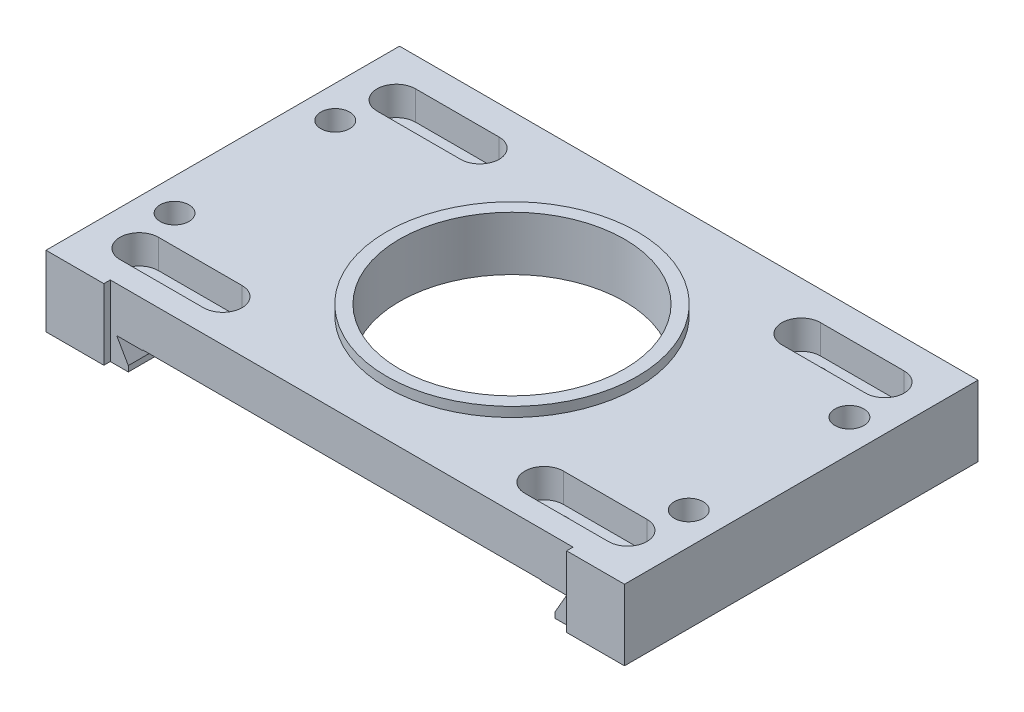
SolidWorks part; units mm, degrees
ref_plane "Front Plane" through (0, 0, 0) normal (0, 0, 1) x (1, 0, 0)
ref_plane "Top Plane" through (0, 0, 0) normal (0, 1, 0) x (1, 0, 0)
ref_plane "Right Plane" through (0, 0, 0) normal (1, 0, 0) x (0, 0, -1)
sketch "Sketch1" plane through (0, 0, 0) normal (1, 0, 0) x (0, 0, -1)
  line L1 (-27.5, -5.5) -> (27.5, -5.5)
  line L2 (-27.5, -5.5) -> (-27.5, 5.5)
  line L3 (-27.5, 5.5) -> (27.5, 5.5)
  line L4 (27.5, -5.5) -> (27.5, 5.5)
  line L5 (-27.5, -5.5) -> (27.5, 5.5) construction
  line L6 (-27.5, 5.5) -> (27.5, -5.5) construction
  point P0 (0, 0)
  dimension "D1" = 11
  dimension "D2" = 55
extrude "Boss-Extrude1" add sketch "Sketch1" along normal mid plane 90
sketch "Sketch2" plane through (0, 0, 27.5) normal (0, 0, 1) x (1, 0, 0)
  line L0 (-32.6906, -5.5) -> (-35, -1.5)
  line L1 (45, -5.5) -> (-45, -5.5) construction
  line L2 (-35, -1.5) -> (35, -1.5)
  line L3 (35, -1.5) -> (32.6906, -5.5)
  line L4 (32.6906, -5.5) -> (-32.6906, -5.5)
  dimension "D1" = 60
  dimension "D2" = 60
  dimension "D3" = 4
  dimension "D4" = 70
  dimension "D5" = 35
extrude "Cut-Extrude1" cut sketch "Sketch2" against normal through all
sketch "Sketch15" plane through (0, -1.5, 0) normal (0, -1, 0) x (1, 0, 0)
  line L0 (35, 27.5) -> (-35, 27.5) construction
  line L1 (-31, -27.5) -> (31, -27.5)
  line L2 (-31, -27.5) -> (-31, 27.5)
  line L3 (-31, 27.5) -> (31, 27.5)
  line L4 (31, -27.5) -> (31, 27.5)
  line L5 (-31, -27.5) -> (31, 27.5) construction
  line L6 (-31, 27.5) -> (31, -27.5) construction
  point P0 (0, 0)
  dimension "D1" = 62
extrude "Cut-Extrude3" cut sketch "Sketch15" against normal blind 0.1
sketch "Sketch16" plane through (0, 0, 27.5) normal (0, 0, 1) x (1, 0, 0)
  line L0 (-32.6906, -5.5) -> (-45, -5.5) construction
  line L1 (-36, -5.5) -> (36, -5.5)
  line L2 (-36, -5.5) -> (-36, 5.5)
  line L3 (-36, 5.5) -> (36, 5.5)
  line L4 (36, -5.5) -> (36, 5.5)
  line L5 (45, 5.5) -> (-45, 5.5) construction
  line L6 (45, 5.5) -> (45, -5.5) construction
  dimension "D1" = 72
  dimension "D2" = 9
extrude "Cut-Extrude4" [suppressed] cut sketch "Sketch16" against normal blind 1.25
sketch "Sketch17" plane through (0, 5.5, 0) normal (0, 1, 0) x (1, 0, 0)
  circle A0 centre (0, 0) radius 19.5
  dimension "D1" = 39
extrude "Boss-Extrude2" add sketch "Sketch17" along normal blind 1.5
sketch "Sketch18" plane through (0, 7, 0) normal (0, 1, 0) x (1, 0, 0)
  circle A0 centre (0, 0) radius 17.5
  dimension "D1" = 35
extrude "Cut-Extrude5" cut sketch "Sketch18" against normal through all
sketch "Sketch22" plane through (0, 5.5, 0) normal (0, 1, 0) x (1, 0, 0)
  line L1 (-25, 20) -> (-38, 20) construction
  line L2 (-25, 17) -> (-38, 17)
  line L3 (-25, 23) -> (-38, 23)
  arc A0 (-25, 17) -> (-25, 23) centre (-25, 20) ccw
  arc A1 (-38, 23) -> (-38, 17) centre (-38, 20) ccw
  circle A4 centre (0, 0) radius 19.5 construction
  point P5 (-31.5, 20)
  dimension "D1" = 3
  dimension "D3" = 31.5
  dimension "D4" = 20
  dimension "D2" = 13
extrude "Cut-Extrude6" cut sketch "Sketch22" against normal blind 4.5
hole_wizard "M3x0.5 Tapped Hole1" positions "Sketch25" profile "Sketch24" tap size "M3x0.5" standard "ANSI Metric"
sketch "Sketch25" plane through (0, 1, 0) normal (0, 1, 0) x (1, 0, 0)
  line L1 (-37.5, 20) -> (-37.5, 23) construction
  line L2 (-25, 23) -> (-38, 23) construction
  line L4 (-37.5, 20) -> (-37.5, 17) construction
  line L5 (-38, 17) -> (-25, 17) construction
  circle A3 centre (0, 0) radius 19.5 construction
  point P0 (-37.5, 20)
  dimension "D1" = 37.5
sketch "Sketch24" plane through (-37.5, 1, -20) normal (1, 0, 0) x (0, 0, 1)
  line L0 (0, 0) -> (0, 5.2511)
  line L1 (0, 5.2511) -> (1.25, 4.5)
  line L2 (1.25, 4.5) -> (1.25, 0)
  line L5 (1.25, 0) -> (0, 0)
  line L10 (0, 5.2511) -> (-1.25, 4.5) construction
  line L11 (0, -6.35) -> (0, 107.95) construction
  dimension "Tap Drill Dia." = 2.5
  dimension "Tap Drill Depth" = 4.5
  dimension "Drill Angle" = 118
hole_wizard "Ø3.1 (3.1) Diameter Hole1" positions "Sketch32" profile "Sketch31" hole size "Ø3.1" standard "ANSI Metric"
sketch "Sketch32" plane through (0, 1, 0) normal (0, 1, 0) x (1, 0, 0)
  line L0 (-37.5, 20) -> (-27, 20) construction
  point P0 (-27, 20)
  dimension "D1" = 10.5
sketch "Sketch31" plane through (-27, 1, -20) normal (1, 0, 0) x (0, 0, 1)
  line L0 (0, 0) -> (0, 3.1313)
  line L1 (0, 3.1313) -> (1.55, 2.2)
  line L2 (1.55, 2.2) -> (1.55, 0)
  line L5 (1.55, 0) -> (0, 0)
  line L10 (0, 3.1313) -> (-1.55, 2.2) construction
  line L11 (0, -6.35) -> (0, 107.95) construction
  dimension "Hole Dia." = 3.1
  dimension "Hole Depth" = 2.2
  dimension "Drill Angle" = 118
mirror "Mirror1" about plane through (0, 0, 0) normal (0, 0, 1) of "Ø3.1 (3.1) Diameter Hole1", "M3x0.5 Tapped Hole1", "Cut-Extrude6"
mirror "Mirror2" about plane through (0, 0, 0) normal (1, 0, 0) of "M3x0.5 Tapped Hole1", "Cut-Extrude6", "Mirror1", "Ø3.1 (3.1) Diameter Hole1"
hole_wizard "CBORE for M4 SHCS3" positions "Sketch27" profile "Sketch26" counterbore size "M4" standard "ANSI Metric"
sketch "Sketch27" plane through (0, -5.5, 0) normal (0, -1, 0) x (-1, 0, 0)
  line L0 (45, -12.5) -> (40, -12.5) construction
  line L1 (45, -27.5) -> (45, 27.5) construction
  line L2 (40, -12.5) -> (-40, -12.5) construction
  line L3 (-40, -12.5) -> (-45, -12.5) construction
  line L4 (-45, -27.5) -> (-45, 27.5) construction
  line L6 (-40, -12.5) -> (-40, 12.5) construction
  line L7 (-40, 12.5) -> (40, 12.5) construction
  line L8 (40, 12.5) -> (40, -12.5) construction
  line L10 (40, -12.5) -> (40, -27.5) construction
  line L11 (32.6906, -27.5) -> (45, -27.5) construction
  line L13 (40, 12.5) -> (40, 27.5) construction
  line L14 (32.6906, 27.5) -> (45, 27.5) construction
  point P0 (40, -12.5)
  point P2 (40, 12.5)
  point P4 (-40, -12.5)
  point P6 (-40, 12.5)
  dimension "D1" = 25
  dimension "D2" = 80
sketch "Sketch26" plane through (-40, -5.5, 12.5) normal (1, 0, 0) x (0, 0, -1)
  line L0 (0, 0) -> (0, 12.5)
  line L1 (0, 12.5) -> (2.25, 12.5)
  line L3 (2.25, 12.5) -> (2.25, 4)
  line L4 (2.25, 4) -> (4, 4)
  line L5 (4, 4) -> (4, 0)
  line L7 (4, 0) -> (0, 0)
  line L11 (0, -6.35) -> (0, 107.95) construction
  dimension "Thru Hole Dia." = 4.5
  dimension "Thru Hole Depth" = 12.5
  dimension "C'Bore Dia." = 8
  dimension "C'Bore Depth" = 4
sketch "Sketch28" plane through (0, 0, 27.5) normal (0, 0, 1) x (1, 0, 0)
  line L0 (45, 5.5) -> (-45, 5.5) construction
  line L1 (-36, -5.5) -> (36, -5.5)
  line L2 (-36, -5.5) -> (-36, 5.5)
  line L3 (-36, 5.5) -> (36, 5.5)
  line L4 (36, -5.5) -> (36, 5.5)
  dimension "D1" = 36
  dimension "D2" = 36
  dimension "D3" = 11
extrude "Cut-Extrude7" cut sketch "Sketch28" against normal blind 1
sketch "Sketch29" plane through (0, -5.5, 0) normal (0, -1, 0) x (1, 0, 0)
  line L0 (-32.6906, -27.5) -> (-32.6906, 26.5) construction
  line L1 (-32.6906, 7.5) -> (-36, 7.5)
  line L2 (-32.6906, 7.5) -> (-32.6906, -8.5)
  line L3 (-32.6906, -8.5) -> (-36, -8.5)
  line L4 (-36, 7.5) -> (-36, -8.5)
  line L5 (32.6906, -27.5) -> (32.6906, 26.5) construction
  line L6 (32.6906, 7.5) -> (36, 7.5)
  line L7 (32.6906, 7.5) -> (32.6906, -8.5)
  line L8 (32.6906, -8.5) -> (36, -8.5)
  line L9 (36, 7.5) -> (36, -8.5)
  line L10 (-36, 27.5) -> (-45, 27.5) construction
  dimension "D1" = 20
  dimension "D2" = 16
  dimension "D3" = 36
extrude "Cut-Extrude8" cut sketch "Sketch29" against normal up to surface (4 mm away)
sketch "Sketch30" plane through (0, 0, 26.5) normal (0, 0, 1) x (1, 0, 0)
  line L0 (-32.6906, -5.5) -> (-33.1906, -4.634)
  line L1 (-35, -1.5) -> (-32.6906, -5.5) construction
  line L2 (-33.1906, -4.634) -> (-33.1906, -5.5)
  line L3 (-36, -5.5) -> (-32.6906, -5.5) construction
  line L4 (-33.1906, -5.5) -> (-32.6906, -5.5)
  dimension "D1" = 0.5
extrude "Cut-Extrude9" cut sketch "Sketch30" against normal through all
mirror "Mirror3" about plane through (0, 0, 0) normal (1, 0, 0) of "Cut-Extrude9"
fillet "Fillet1" radius 2 4 edges at (36, -3.5, 7.5) (36, -3.5, -8.5) (-36, -3.5, -8.5) (-36, -3.5, 7.5)
